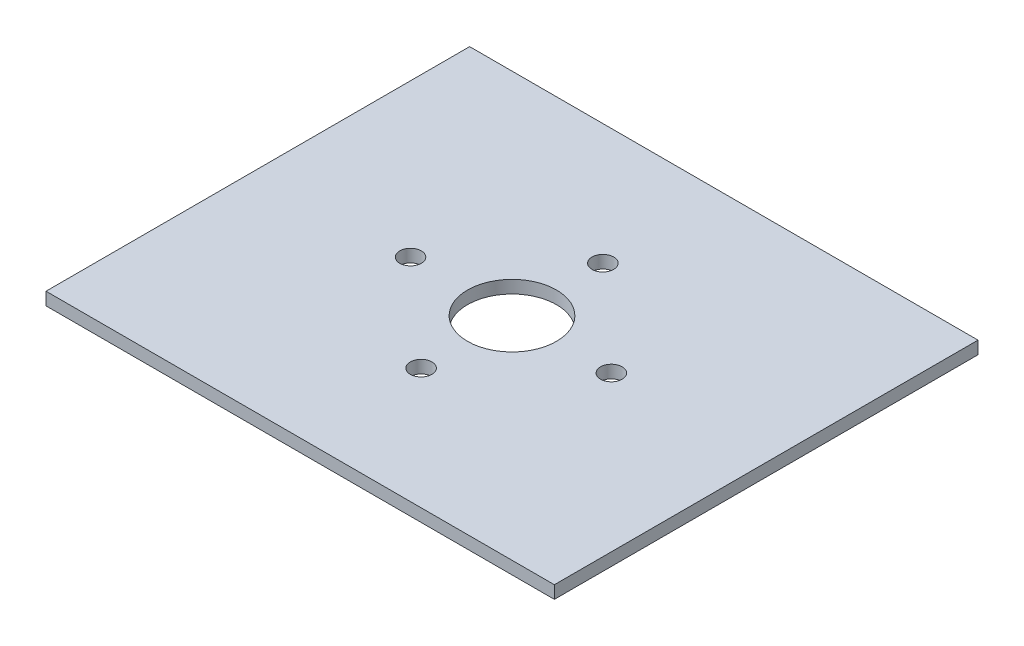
SolidWorks part; units mm, degrees
ref_plane "Front Plane" through (0, 0, 0) normal (0, 0, 1) x (1, 0, 0)
ref_plane "Top Plane" through (0, 0, 0) normal (0, 1, 0) x (1, 0, 0)
ref_plane "Right Plane" through (0, 0, 0) normal (1, 0, 0) x (0, 0, -1)
sketch "Sketch1" plane through (0, 0, 0) normal (0, 1, 0) x (1, 0, 0)
  line L0 (60, 0) -> (60, -100) construction
  line L2 (0, 0) -> (0, -100)
  line L4 (120, 0) -> (120, -100)
  line L5 (0, -50) -> (120, -50) construction
  line L6 (31, -50) -> (89, -50) construction
  line L7 (0, 0) -> (120, 0)
  line L8 (36.05, -50) -> (83.45, -50) construction
  line L9 (0, -100) -> (120, -100)
  circle A0 centre (60, -50) radius 29 construction
  circle A1 centre (36.05, -50) radius 2.55
  circle A2 centre (83.45, -50) radius 2.55
  circle A3 centre (60, -28.55) radius 2.55
  circle A4 centre (60, -71.45) radius 2.55
  point P21 (60, -50)
  point P22 (0, 0)
  point P23 (60, -50)
  point P26 (60, -50)
  dimension "D2" = 58
  dimension "D3" = 5.1
  dimension "D4" = 5.1
  dimension "D5" = 5.1
  dimension "D6" = 5.1
  dimension "D9" = 52.5
  dimension "D10" = 24
  dimension "D11" = 120
  dimension "D1" = 100
  dimension "D7" = 26
  dimension "D8" = 48
extrude "Boss-Extrude1" add sketch "Sketch1" along normal blind 3
sketch "Sketch2" plane through (0, 3, 0) normal (0, 1, 0) x (1, 0, 0)
  line L0 (60, 0) -> (60, -100) construction
  line L1 (120, 0) -> (0, 0) construction
  line L2 (0, -100) -> (120, -100) construction
  line L3 (0, -50) -> (120, -50) construction
  line L4 (0, 0) -> (0, -100) construction
  line L5 (120, -100) -> (120, 0) construction
  circle A0 centre (60, -50) radius 10.5
  dimension "D1" = 21
extrude "Cut-Extrude1" cut sketch "Sketch2" against normal through all
